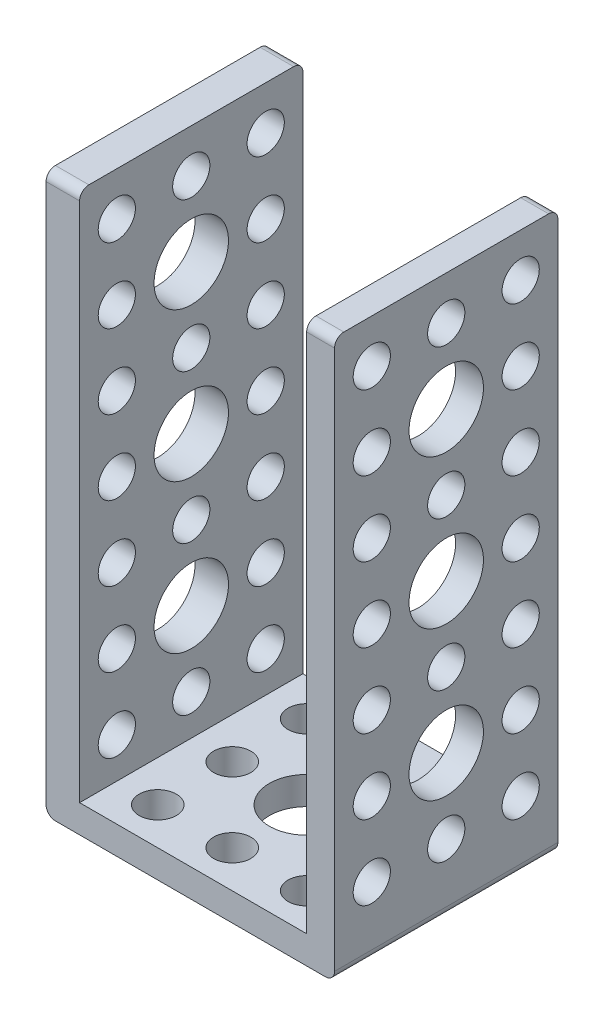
SolidWorks part; units mm, degrees
ref_plane "Front" through (0, 0, 0) normal (0, 0, 1) x (1, 0, 0)
ref_plane "Top" through (0, 0, 0) normal (0, 1, 0) x (1, 0, 0)
ref_plane "Right" through (0, 0, 0) normal (1, 0, 0) x (0, 0, -1)
sketch "草图1" plane through (0, 0, 0) normal (0, 0, 1) x (1, 0, 0)
  line L0 (-3.601, -23.9899) -> (27.399, -23.9899)
  line L1 (27.399, -23.9899) -> (27.399, 36.0101)
  line L2 (27.399, 36.0101) -> (24.399, 36.0101)
  line L3 (24.399, 36.0101) -> (24.399, -20.9899)
  line L4 (24.399, -20.9899) -> (0, -20.9899)
  line L5 (0, -20.9899) -> (0, 36.0101)
  line L6 (0, 36.0101) -> (-3.601, 36.0101)
  line L7 (-3.601, 36.0101) -> (-3.601, -23.9899)
  dimension "D1" = 31
  dimension "D2" = 3
  dimension "D3" = 60
  dimension "D4" = 60
  dimension "D5" = 3.601
  dimension "D6" = 57
extrude "凸台-拉伸1" add sketch "草图1" along normal blind 24
sketch "草图3" plane through (0, -20.9899, 0) normal (0, 1, 0) x (1, 0, 0)
  line L1 (24.399, 0) -> (12.399, 0)
  line L2 (24.399, 0) -> (24.399, -12)
  line L5 (24.399, 0) -> (20.399, 0)
  line L6 (24.399, 0) -> (24.399, -4)
  circle A0 centre (12.399, -12) radius 4
  circle A1 centre (20.399, -4) radius 2
  circle A2 centre (12.399, -4) radius 2
  circle A3 centre (4.399, -4) radius 2
  circle A5 centre (4.399, -12) radius 2
  circle A6 centre (20.399, -12) radius 2
  circle A7 centre (12.399, -20) radius 2
  circle A8 centre (4.399, -20) radius 2
  circle A9 centre (20.399, -20) radius 2
  circle A10 centre (12.399, -12) radius 2
  dimension "D5" = 3
  dimension "D6" = 3
extrude "切除-拉伸1" cut sketch "草图3" against normal through all contours A3 | A2 | A6 | A9 | A7 | A5 | A0 | A1 | A8
sketch "草图4" plane through (-3.601, 0, 0) normal (-1, 0, 0) x (0, 0, 1)
  circle A0 centre (12, 31.3395) radius 2
  circle A1 centre (20, 31.3395) radius 2
  circle A2 centre (4, 31.3395) radius 2
  circle A3 centre (4, 23.3395) radius 2
  circle A5 centre (20, 23.3395) radius 2
  circle A6 centre (4, 15.3395) radius 2
  circle A7 centre (12, 15.3395) radius 2
  circle A8 centre (20, 15.3395) radius 2
  circle A9 centre (4, 7.3395) radius 2
  circle A11 centre (20, 7.3395) radius 2
  circle A12 centre (4, -0.6605) radius 2
  circle A13 centre (12, -0.6605) radius 2
  circle A14 centre (20, -0.6605) radius 2
  circle A15 centre (4, -8.6605) radius 2
  circle A17 centre (20, -8.6605) radius 2
  circle A18 centre (4, -16.6605) radius 2
  circle A19 centre (12, -16.6605) radius 2
  circle A20 centre (20, -16.6605) radius 2
  circle A21 centre (12, 23.3395) radius 2
  circle A22 centre (12, 7.3395) radius 2
  circle A23 centre (12, -8.6605) radius 2
  circle A24 centre (12, 23.3395) radius 4
  circle A25 centre (12, 7.3395) radius 4
  circle A26 centre (12, -8.6605) radius 4
  dimension "D2" = 2
  dimension "D3" = 2
  dimension "D4" = 7
extrude "切除-拉伸2" cut sketch "草图4" against normal through all
fillet "圆角1" radius 1 6 edges at (-3.601, -23.9899, 12) (27.399, -23.9899, 12) (25.899, 36.0101, 0) (-1.8005, 36.0101, 0) (-1.8005, 36.0101, 24) (25.899, 36.0101, 24)
